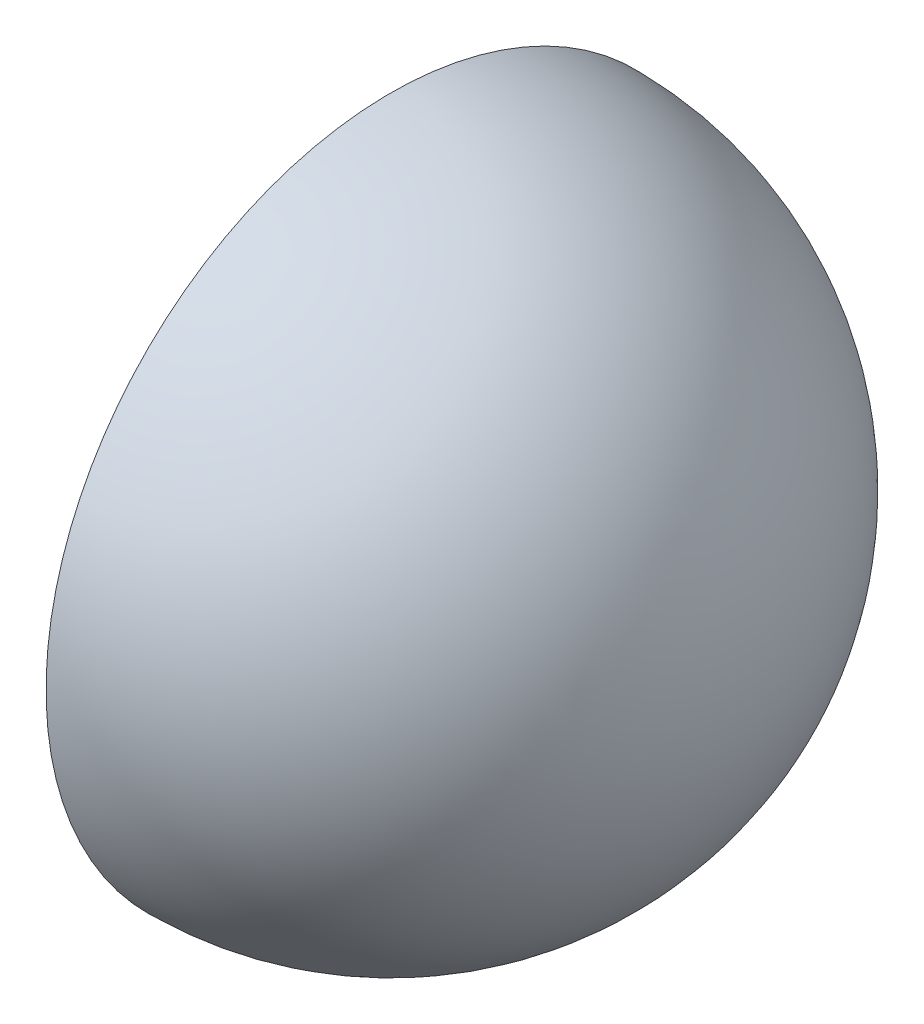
SolidWorks part; units mm, degrees
ref_plane "Front Plane" through (0, 0, 0) normal (0, 0, 1) x (1, 0, 0)
ref_plane "Top Plane" through (0, 0, 0) normal (0, 1, 0) x (1, 0, 0)
ref_plane "Right Plane" through (0, 0, 0) normal (1, 0, 0) x (0, 0, -1)
sketch "Sketch1" plane through (0, 0, 0) normal (0, 0, 1) x (1, 0, 0)
  line L0 (0, -50.8) -> (0, 50.8) construction
  line L1 (0, -50.8) -> (0, -38.1)
  line L2 (0, 38.1) -> (0, 50.8)
  arc A0 (0, 38.1) -> (0, -38.1) centre (0, 0) ccw
  arc A1 (0, -50.8) -> (0, 50.8) centre (0, 0) cw
  dimension "D1" = 38.1
  dimension "D2" = 12.7
revolve "Revolve2" add sketch "Sketch1" angle 360 about L0
sketch "Sketch2" plane through (0, 0, 0) normal (1, 0, 0) x (0, 0, -1)
  line L0 (-50.8, -50.8) -> (-50.8, 50.8)
  line L1 (-50.8, -50.8) -> (50.8, -50.8)
  line L2 (-50.8, 50.8) -> (50.8, 50.8)
  line L3 (50.8, -50.8) -> (50.8, 50.8)
  line L4 (-50.8, -50.8) -> (50.8, 50.8) construction
  line L5 (-50.8, 50.8) -> (50.8, -50.8) construction
  circle A0 centre (0, 0) radius 50.8 construction
  point P1 (0, 0)
extrude "Cut-Extrude1" cut sketch "Sketch2" against normal through all
